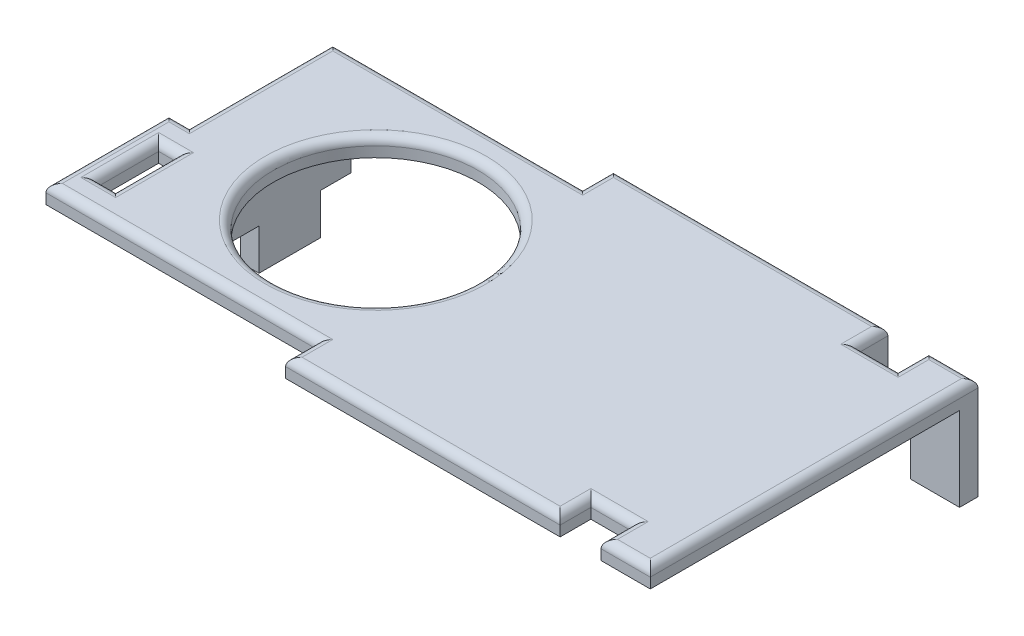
SolidWorks part; units mm, degrees
ref_plane "Front Plane" through (0, 0, 0) normal (0, 0, 1) x (1, 0, 0)
ref_plane "Top Plane" through (0, 0, 0) normal (0, 1, 0) x (1, 0, 0)
ref_plane "Right Plane" through (0, 0, 0) normal (1, 0, 0) x (0, 0, -1)
sketch "Sketch1" plane through (0, 0, 0) normal (0, 1, 0) x (1, 0, 0)
  line L0 (0, 0) -> (-61.082, 0) construction
  line L1 (0, -10.16) -> (0, 10.16)
  line L2 (0, 10.16) -> (-3.048, 10.16)
  line L3 (-3.048, 10.16) -> (-3.048, 8.255)
  line L4 (-3.048, 8.255) -> (-5.588, 8.255)
  line L5 (-5.588, 8.255) -> (-5.588, 10.16)
  line L6 (-5.588, 10.16) -> (-22.606, 10.16)
  line L7 (-22.606, 10.16) -> (-22.606, 8.255)
  line L8 (-22.606, 8.255) -> (-38.1, 8.255)
  line L9 (-22.606, -8.255) -> (-39.37, -8.255)
  line L10 (-22.606, -10.16) -> (-22.606, -8.255)
  line L11 (-5.588, -10.16) -> (-22.606, -10.16)
  line L12 (-5.588, -8.255) -> (-5.588, -10.16)
  line L13 (-3.048, -8.255) -> (-5.588, -8.255)
  line L14 (-3.048, -10.16) -> (-3.048, -8.255)
  line L15 (0, -10.16) -> (-3.048, -10.16)
  line L16 (-38.1, 8.255) -> (-38.1, -0.635)
  line L17 (-38.1, -0.635) -> (-39.37, -0.635)
  line L18 (-39.37, -0.635) -> (-39.37, -8.255)
  dimension "D1" = 20.32
  dimension "D2" = 3.048
  dimension "D3" = 2.54
  dimension "D4" = 17.018
  dimension "D5" = 15.494
  dimension "D6" = 1.905
  dimension "D7" = 1.27
  dimension "D8" = 7.62
extrude "Boss-Extrude1" add sketch "Sketch1" along normal blind 1.143
sketch "Sketch4" plane through (0, 1.143, 0) normal (0, 1, 0) x (1, 0, 0)
  line L0 (0, -10.16) -> (0, 10.16) construction
  line L1 (-3.048, 10.16) -> (0, 10.16)
  line L2 (-3.048, 10.16) -> (-3.048, 9.017)
  line L3 (-3.048, 9.017) -> (0, 9.017)
  line L4 (0, 10.16) -> (0, 9.017)
  line L6 (-5.588, 10.16) -> (-14.605, 10.16)
  line L7 (-5.588, 10.16) -> (-5.588, 9.017)
  line L8 (-5.588, 9.017) -> (-14.605, 9.017)
  line L9 (-14.605, 10.16) -> (-14.605, 9.017)
  dimension "D1" = 1.143
  dimension "D2" = 9.017
extrude "Boss-Extrude2" add sketch "Sketch4" against normal blind 6.35
sketch "Sketch7" plane through (-38.1, 0, 0) normal (-1, 0, 0) x (0, 0, 1)
  line L0 (-4.445, 1.143) -> (-4.445, -6.2961) construction
  line L1 (-8.255, 1.143) -> (0.635, 1.143) construction
  line L2 (-0.635, 1.143) -> (-8.255, 1.143)
  line L3 (-8.255, 1.143) -> (-8.255, -5.334)
  line L4 (-8.255, -5.334) -> (-6.35, -5.334)
  line L5 (-6.35, -5.334) -> (-6.35, -7.874)
  line L6 (-6.35, -7.874) -> (-2.54, -7.874)
  line L7 (-2.54, -5.334) -> (-2.54, -7.874)
  line L8 (-0.635, -5.334) -> (-2.54, -5.334)
  line L9 (-0.635, 1.143) -> (-0.635, -5.334)
  line L11 (-8.255, 1.143) -> (-8.255, 0) construction
  point P10 (-4.445, -7.874)
  dimension "D1" = 6.477
  dimension "D2" = 1.905
  dimension "D3" = 2.54
  dimension "D4" = 3.81
extrude "Boss-Extrude3" add sketch "Sketch7" against normal blind 1.143
sketch "Sketch8" plane through (0, 1.143, 0) normal (0, 1, 0) x (1, 0, 0)
  line L0 (0, -10.16) -> (0, 10.16) construction
  line L1 (-39.37, -8.255) -> (-22.606, -8.255) construction
  line L2 (-39.37, -0.635) -> (-39.37, -8.255) construction
  line L3 (-38.1, -2.54) -> (-36.957, -2.54)
  line L4 (-38.1, -2.54) -> (-38.1, -6.35)
  line L5 (-38.1, -6.35) -> (-36.957, -6.35)
  line L6 (-36.957, -2.54) -> (-36.957, -6.35)
  circle A0 centre (-27.178, 0) radius 6.35
  dimension "D1" = 12.7
  dimension "D2" = 27.178
  dimension "D3" = 8.255
  dimension "D4" = 3.81
  dimension "D5" = 1.143
  dimension "D6" = 1.27
  dimension "D7" = 1.905
extrude "Cut-Extrude1" cut sketch "Sketch8" against normal through all
fillet "Fillet1" radius 0.508 23 edges at (-30.353, 1.143, -8.255) (-22.606, 1.143, -9.2075) (-14.097, 1.143, -10.16) (-5.588, 1.143, -9.2075) (-4.318, 1.143, -8.255) (-3.048, 1.143, -9.2075) (-1.524, 1.143, -10.16) (0, 1.143, 0) (-1.524, 1.143, 10.16) (-3.048, 1.143, 9.2075) (-4.318, 1.143, 8.255) (-5.588, 1.143, 9.2075) (-14.097, 1.143, 10.16) (-22.606, 1.143, 9.2075) (-30.988, 1.143, 8.255) (-39.37, 1.143, 4.445) (-38.735, 1.143, 0.635) (-38.1, 1.143, -3.81) (-27.178, 1.143, 6.35) (-37.5285, 1.143, 6.35) (-36.957, 1.143, 4.445) (-37.5285, 1.143, 2.54) (-38.1, 1.143, 4.445)
